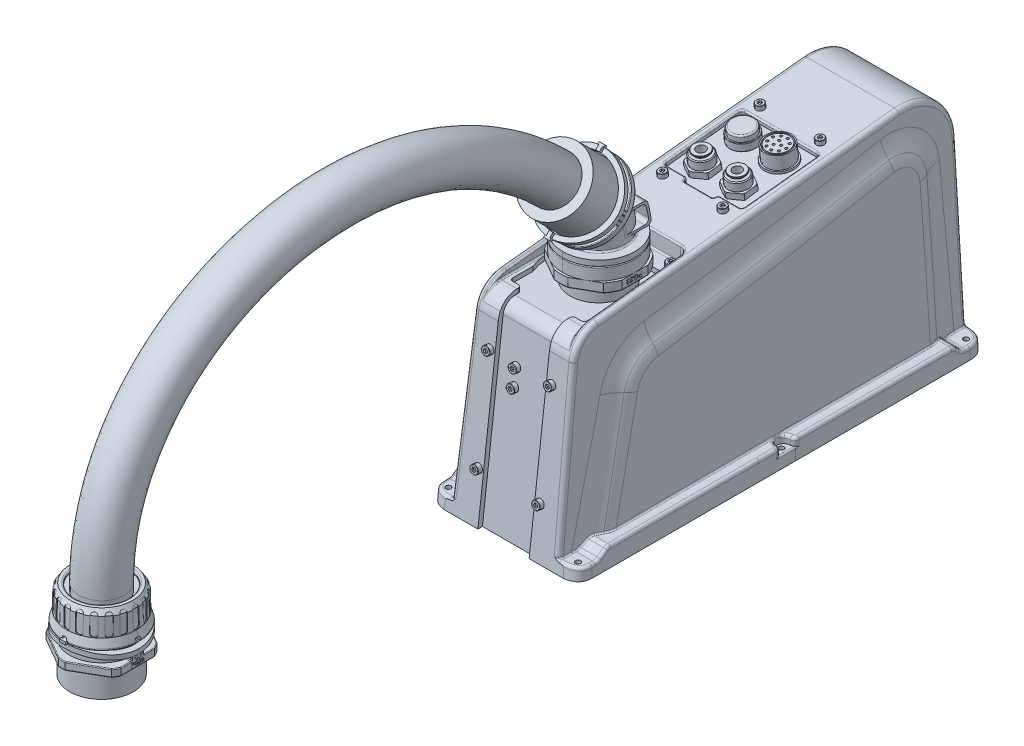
SolidWorks part; units mm, degrees
ref_plane "前视基准面" through (0, 0, 0) normal (0, 0, 1) x (1, 0, 0)
ref_plane "上视基准面" through (0, 0, 0) normal (0, 1, 0) x (1, 0, 0)
ref_plane "右视基准面" through (0, 0, 0) normal (1, 0, 0) x (0, 0, -1)
imported_body "MB10SC-600.sldasm-Part-1-1-solid1"
imported_body "MB10SC-600.sldasm-Part-2-1-solid1"
imported_body "MB10SC-600.sldasm-Part-3-1-solid1"
imported_body "MB10SC-600.sldasm-Part-4-1-solid1"
imported_body "MB10SC-600.sldasm-Part-5-1-solid1"
imported_body "MB10SC-600.sldasm-Part-6-1-solid1"
imported_body "MB10SC-600.sldasm-Part-7-1-solid1"
imported_body "MB10SC-600.sldasm-Part-8-1-solid1"
imported_body "MB10SC-600.sldasm-Part-9-1-solid1"
imported_body "MB10SC-600.sldasm-Part-10-1-solid1"
imported_body "MB10SC-600.sldasm-Part-11-1-solid1"
imported_body "MB10SC-600.sldasm-Part-12-1-solid1"
imported_body "MB10SC-600.sldasm-Part-13-1-solid1"
imported_body "MB10SC-600.sldasm-Part-14-1-solid1"
imported_body "MB10SC-600.sldasm-Part-15-1-solid1"
imported_body "MB10SC-600.sldasm-Part-16-1-solid1"
imported_body "MB10SC-600.sldasm-Part-17-1-solid1"
imported_body "MB10SC-600.sldasm-Part-18-1-solid1"
delete or keep bodies "实体-删除/保留 1" type keep bodies bodies 124 123 122 121
